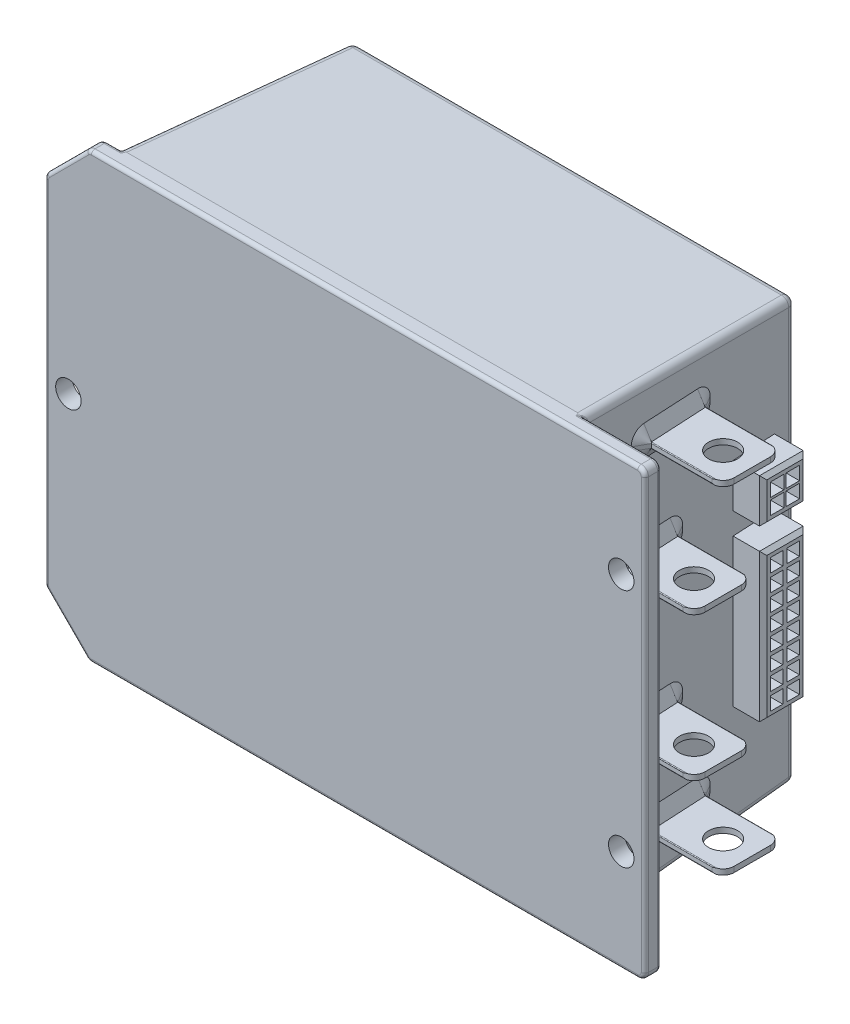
SolidWorks part; units mm, degrees
ref_plane "Plan1" through (0, 0, 0) normal (0, 0, 1) x (1, 0, 0)
ref_plane "Plan2" through (0, 0, 0) normal (0, 1, 0) x (1, 0, 0)
ref_plane "Plan3" through (0, 0, 0) normal (1, 0, 0) x (0, 0, -1)
sketch "Esquisse2" plane through (0, 0, 0) normal (0, 0, 1) x (1, 0, 0)
  line L0 (-64, 61) -> (64, 61)
  line L1 (-64, 61) -> (-64, -61)
  line L2 (64, -61) -> (-64, -61)
  line L3 (64, -61) -> (64, 61)
  line L4 (0, 45.8746) -> (0, -45.8746) construction
  line L5 (-80.7749, 0) -> (80.7749, 0) construction
  dimension "D1" = 128
  dimension "D2" = 122
extrude "Base-Extrusion" add sketch "Esquisse2" along normal blind 61
draft "Dépouille2" type of draft neutral plane draft angle 3 faces to draft 4 parameters "D1"=3
sketch "Esquisse3" plane through (0, 0, 61) normal (0, 0, 1) x (1, 0, 0)
  line L0 (-68, 61) -> (85, 61)
  line L1 (-80, 49) -> (-80, -49)
  line L2 (85, -61) -> (-68, -61)
  line L3 (85, -61) -> (85, 61)
  line L4 (-64, 61) -> (64, 61) construction
  line L5 (64, -61) -> (-64, -61) construction
  line L6 (64, -61) -> (64, 61) construction
  line L7 (-64, 61) -> (-64, -61) construction
  line L8 (-68, 61) -> (-80, 49)
  line L9 (-80, -49) -> (-68, -61)
  dimension "D1" = 21
  dimension "D2" = 16
  dimension "D3" = 12
  dimension "D4" = 45
  dimension "D5" = 12
extrude "Boss.-Extru.1" add sketch "Esquisse3" along normal blind 4.5
sketch "Esquisse4" plane through (0, 0, 65.5) normal (0, 0, 1) x (1, 0, 0)
  line L0 (-85.6585, 0) -> (85.6585, 0) construction
  line L1 (78.5, 62.3645) -> (78.5, -71.0751) construction
  line L4 (85, -61) -> (85, 61) construction
  circle A0 centre (-73.5, 0) radius 3.5
  circle A1 centre (78.5, 33) radius 3.5
  circle A3 centre (78.5, -33) radius 3.5
  dimension "D1" = 152
  dimension "D2" = 7
  dimension "D3" = 66
  dimension "D4" = 6.5
extrude "Enlèv. mat.-Extru.1" cut sketch "Esquisse4" against normal through all
fillet "Congé1" radius 2
fillet "Congé2" radius 1
fillet "Congé3" radius 1
sketch "Esquisse5" plane through (0, 0, 0) normal (1, 0, 0) x (0, 0, -1)
  line L0 (-74.5892, 0) -> (13.0799, 0) construction
  line L1 (-70.0338, -33) -> (7.7834, -33) construction
  line L2 (-36, 20.3) -> (-36, 19.2)
  line L4 (-61, 59) -> (-61, -59) construction
  line L5 (-43.8, -45.5) -> (-28.2, -45.5)
  line L6 (-44, -45.7) -> (-44, -46.8)
  line L7 (-28.2, -47) -> (-43.8, -47)
  line L8 (-28, -46.8) -> (-28, -45.7)
  line L9 (-28, 46.8) -> (-28, 45.7)
  line L10 (-28.2, 47) -> (-43.8, 47)
  line L11 (-44, 45.7) -> (-44, 46.8)
  line L13 (-43.8, 45.5) -> (-28.2, 45.5)
  line L14 (-51.8, -19) -> (-36.2, -19)
  line L15 (-52, -19.2) -> (-52, -20.3)
  line L16 (-36.2, -20.5) -> (-51.8, -20.5)
  line L17 (-36, -20.3) -> (-36, -19.2)
  line L18 (-36.2, 20.5) -> (-51.8, 20.5)
  line L19 (-52, 19.2) -> (-52, 20.3)
  line L20 (-51.8, 19) -> (-36.2, 19)
  arc A0 (-28.2, -45.5) -> (-28, -45.7) centre (-28.2, -45.7) cw
  arc A1 (-28, -46.8) -> (-28.2, -47) centre (-28.2, -46.8) cw
  arc A2 (-44, -46.8) -> (-43.8, -47) centre (-43.8, -46.8) ccw
  arc A3 (-43.8, -45.5) -> (-44, -45.7) centre (-43.8, -45.7) ccw
  arc A4 (-43.8, 45.5) -> (-44, 45.7) centre (-43.8, 45.7) cw
  arc A5 (-44, 46.8) -> (-43.8, 47) centre (-43.8, 46.8) cw
  arc A6 (-28, 46.8) -> (-28.2, 47) centre (-28.2, 46.8) ccw
  arc A7 (-28.2, 45.5) -> (-28, 45.7) centre (-28.2, 45.7) ccw
  arc A8 (-36.2, -19) -> (-36, -19.2) centre (-36.2, -19.2) cw
  arc A9 (-36, -20.3) -> (-36.2, -20.5) centre (-36.2, -20.3) cw
  arc A10 (-52, -20.3) -> (-51.8, -20.5) centre (-51.8, -20.3) ccw
  arc A11 (-51.8, -19) -> (-52, -19.2) centre (-51.8, -19.2) ccw
  arc A12 (-51.8, 19) -> (-52, 19.2) centre (-51.8, 19.2) cw
  arc A13 (-52, 20.3) -> (-51.8, 20.5) centre (-51.8, 20.3) cw
  arc A14 (-36, 20.3) -> (-36.2, 20.5) centre (-36.2, 20.3) ccw
  arc A15 (-36.2, 19) -> (-36, 19.2) centre (-36.2, 19.2) ccw
  point P13 (-28, -45.5)
  point P16 (-28, -47)
  point P19 (-44, -47)
  dimension "D3" = 0.2
  dimension "D8" = 0.2
  dimension "D1" = 16
  dimension "D2" = 1.5
  dimension "D4" = 19
  dimension "D5" = 33
  dimension "D6" = 12.5
  dimension "D7" = 17
  dimension "D9" = 1.5
  dimension "D10" = 16
  dimension "D11" = 9
extrude "Boss.-Extru.2" add sketch "Esquisse5" along normal up to surface (85 mm away)
sketch "Esquisse6" plane through (0, 20.5, 0) normal (0, 1, 0) x (-1, 0, 0)
  line L0 (-88.2041, 32.8007) -> (-78.5, 32.8007)
  line L1 (-88.2041, 32.8007) -> (-88.2041, 55.4851)
  line L2 (-78.5, 55.4851) -> (-88.2041, 55.4851)
  line L3 (-78.5, 55.4851) -> (-78.5, 52)
  line L4 (-82, 36) -> (-78.5, 36)
  line L5 (-85, 39) -> (-85, 49)
  line L6 (-78.5, 52) -> (-82, 52)
  line L7 (-85, 52) -> (-63.5283, 52) construction
  line L8 (-78.5, 61) -> (-78.5, 65.5) construction
  line L9 (-78.5, 36) -> (-78.5, 32.8007)
  line L10 (-85, 36.2) -> (-85, 51.8) construction
  line L11 (-85, 36) -> (-62.6898, 36) construction
  line L14 (-70.6796, 44) -> (-92.9618, 44) construction
  arc A0 (-85, 49) -> (-82, 52) centre (-82, 49) cw
  arc A1 (-85, 39) -> (-82, 36) centre (-82, 39) ccw
  circle A2 centre (-77, 44) radius 4
  dimension "D1" = 3
  dimension "D2" = 8
  dimension "D3" = 8
extrude "Enlèv. mat.-Extru.2" cut sketch "Esquisse6" against normal up to surface (41 mm away)
sketch "Esquisse7" plane through (0, -47, 0) normal (0, -1, 0) x (1, 0, 0)
  line L0 (89.5908, 51.428) -> (76.5147, 51.428)
  line L1 (89.5908, 51.428) -> (89.5908, 24.6402)
  line L2 (76.5147, 24.6402) -> (89.5908, 24.6402)
  line L3 (76.5147, 24.6402) -> (76.5147, 28)
  line L4 (82, 44) -> (76.5147, 44)
  line L5 (85, 41) -> (85, 31)
  line L6 (76.5147, 28) -> (82, 28)
  line L7 (85, 28) -> (62.2705, 28) construction
  line L8 (76.5147, 44) -> (76.5147, 51.428)
  line L9 (85, 43.8) -> (85, 28.2) construction
  line L10 (85, 44) -> (63.1091, 44) construction
  line L11 (88.0471, 36) -> (68.3724, 36) construction
  arc A0 (85, 31) -> (82, 28) centre (82, 31) cw
  arc A1 (85, 41) -> (82, 44) centre (82, 41) ccw
  circle A2 centre (77, 36) radius 4
  dimension "D1" = 3
  dimension "D2" = 8
  dimension "D3" = 8
extrude "Enlèv. mat.-Extru.3" cut sketch "Esquisse7" against normal blind 2
sketch "Esquisse8" plane through (0, 47, 0) normal (0, 1, 0) x (-1, 0, 0)
  line L0 (-87.5562, 24.8397) -> (-75.1472, 24.8397)
  line L1 (-87.5562, 24.8397) -> (-87.5562, 50.9732)
  line L2 (-75.1472, 50.9732) -> (-87.5562, 50.9732)
  line L3 (-75.1472, 50.9732) -> (-75.1472, 44)
  line L4 (-82, 28) -> (-75.1472, 28)
  line L5 (-85, 31) -> (-85, 41)
  line L6 (-75.1472, 44) -> (-82, 44)
  line L7 (-85, 44) -> (-63.1091, 44) construction
  line L8 (-75.1472, 28) -> (-75.1472, 24.8397)
  line L9 (-85, 43.8) -> (-85, 28.2) construction
  line L10 (-85, 28) -> (-62.2705, 28) construction
  line L11 (-90.3771, 36) -> (-66.9068, 36) construction
  arc A0 (-85, 41) -> (-82, 44) centre (-82, 41) cw
  arc A1 (-82, 28) -> (-85, 31) centre (-82, 31) cw
  circle A2 centre (-77, 36) radius 4
  dimension "D1" = 3
  dimension "D2" = 8
  dimension "D3" = 8
extrude "Enlèv. mat.-Extru.4" cut sketch "Esquisse8" against normal blind 2
chamfer "Chanfrein1" distance 2 angle 60
sketch "Esquisse9" plane through (0, 0, 0) normal (1, 0, 0) x (0, 0, -1)
  line L0 (-18, 28) -> (-6, 28)
  line L1 (-18, 28) -> (-18, 16)
  line L2 (-6, 16) -> (-18, 16)
  line L3 (-6, 16) -> (-6, 28)
  line L4 (-18, 10) -> (-6, 10)
  line L5 (-18, 10) -> (-18, -30.6)
  line L6 (-6, -30.6) -> (-18, -30.6)
  line L7 (-6, -30.6) -> (-6, 10)
  line L8 (-11.7, 26) -> (-8, 26)
  line L9 (-11.7, 26) -> (-11.7, 22.3)
  line L10 (-8, 22.3) -> (-11.7, 22.3)
  line L11 (-8, 22.3) -> (-8, 26)
  line L13 (-8, 8) -> (-11.4, 8)
  line L14 (-8, 8) -> (-8, 4.3)
  line L15 (-11.4, 4.3) -> (-8, 4.3)
  line L16 (-11.4, 4.3) -> (-11.4, 8)
  line L17 (-12, 30.1492) -> (-12, -35.6662) construction
  line L18 (-21.9002, 22) -> (1.0998, 22) construction
  line L19 (0, 55.9052) -> (0, -55.9052) construction
  line L20 (50, 0) -> (-50, 0) construction
  line L21 (-16, 22.3) -> (-16, 26)
  line L22 (-16, 22.3) -> (-12.3, 22.3)
  line L23 (-12.3, 26) -> (-12.3, 22.3)
  line L24 (-12.3, 26) -> (-16, 26)
  line L25 (-12.3, 18) -> (-16, 18)
  line L26 (-12.3, 18) -> (-12.3, 21.7)
  line L27 (-16, 21.7) -> (-12.3, 21.7)
  line L28 (-16, 21.7) -> (-16, 18)
  line L29 (-8, 21.7) -> (-8, 18)
  line L30 (-8, 21.7) -> (-11.7, 21.7)
  line L31 (-11.7, 18) -> (-11.7, 21.7)
  line L32 (-11.7, 18) -> (-8, 18)
  line L33 (-22.4192, 3.8) -> (-4.0583, 3.8) construction
  line L34 (-12.6, 4.3) -> (-12.6, 8)
  line L35 (-12.6, 4.3) -> (-16, 4.3)
  line L36 (-16, 8) -> (-16, 4.3)
  line L37 (-16, 8) -> (-12.6, 8)
  line L38 (-16, -0.4) -> (-12.6, -0.4)
  line L39 (-16, -0.4) -> (-16, 3.3)
  line L40 (-12.6, 3.3) -> (-16, 3.3)
  line L41 (-12.6, 3.3) -> (-12.6, -0.4)
  line L42 (-11.4, 3.3) -> (-11.4, -0.4)
  line L43 (-11.4, 3.3) -> (-8, 3.3)
  line L44 (-8, -0.4) -> (-8, 3.3)
  line L45 (-8, -0.4) -> (-11.4, -0.4)
  line L46 (-22.4192, -0.9) -> (-3.4049, -0.9) construction
  line L47 (-8, -1.4) -> (-11.4, -1.4)
  line L48 (-8, -1.4) -> (-8, -5.1)
  line L49 (-11.4, -5.1) -> (-8, -5.1)
  line L50 (-11.4, -5.1) -> (-11.4, -1.4)
  line L51 (-12.6, -5.1) -> (-12.6, -1.4)
  line L52 (-12.6, -5.1) -> (-16, -5.1)
  line L53 (-16, -1.4) -> (-16, -5.1)
  line L54 (-16, -1.4) -> (-12.6, -1.4)
  line L55 (-16, -9.8) -> (-12.6, -9.8)
  line L56 (-16, -9.8) -> (-16, -6.1)
  line L57 (-12.6, -6.1) -> (-16, -6.1)
  line L58 (-12.6, -6.1) -> (-12.6, -9.8)
  line L59 (-11.4, -6.1) -> (-11.4, -9.8)
  line L60 (-11.4, -6.1) -> (-8, -6.1)
  line L61 (-8, -9.8) -> (-8, -6.1)
  line L62 (-8, -9.8) -> (-11.4, -9.8)
  line L63 (-21.1124, -10.3) -> (-4.0583, -10.3) construction
  line L64 (-8, -10.8) -> (-11.4, -10.8)
  line L65 (-8, -10.8) -> (-8, -14.5)
  line L66 (-11.4, -14.5) -> (-8, -14.5)
  line L67 (-11.4, -14.5) -> (-11.4, -10.8)
  line L68 (-12.6, -14.5) -> (-12.6, -10.8)
  line L69 (-12.6, -14.5) -> (-16, -14.5)
  line L70 (-16, -10.8) -> (-16, -14.5)
  line L71 (-16, -10.8) -> (-12.6, -10.8)
  line L72 (-16, -19.2) -> (-12.6, -19.2)
  line L73 (-16, -19.2) -> (-16, -15.5)
  line L74 (-12.6, -15.5) -> (-16, -15.5)
  line L75 (-12.6, -15.5) -> (-12.6, -19.2)
  line L76 (-11.4, -15.5) -> (-11.4, -19.2)
  line L77 (-11.4, -15.5) -> (-8, -15.5)
  line L78 (-8, -19.2) -> (-8, -15.5)
  line L79 (-8, -19.2) -> (-11.4, -19.2)
  line L80 (-8, -20.2) -> (-11.4, -20.2)
  line L81 (-8, -20.2) -> (-8, -23.9)
  line L82 (-11.4, -23.9) -> (-8, -23.9)
  line L83 (-11.4, -23.9) -> (-11.4, -20.2)
  line L84 (-12.6, -23.9) -> (-12.6, -20.2)
  line L85 (-12.6, -23.9) -> (-16, -23.9)
  line L86 (-16, -20.2) -> (-16, -23.9)
  line L87 (-16, -20.2) -> (-12.6, -20.2)
  line L88 (-16, -28.6) -> (-12.6, -28.6)
  line L89 (-16, -28.6) -> (-16, -24.9)
  line L90 (-12.6, -24.9) -> (-16, -24.9)
  line L91 (-12.6, -24.9) -> (-12.6, -28.6)
  line L92 (-11.4, -24.9) -> (-11.4, -28.6)
  line L93 (-11.4, -24.9) -> (-8, -24.9)
  line L94 (-8, -28.6) -> (-8, -24.9)
  line L95 (-8, -28.6) -> (-11.4, -28.6)
  dimension "D1" = 12
  dimension "D2" = 12
  dimension "D3" = 12
  dimension "D4" = 22
  dimension "D5" = 0.3
  dimension "D6" = 0.3
  dimension "D7" = 2
  dimension "D8" = 2
  dimension "D9" = 6
  dimension "D10" = 2
  dimension "D11" = 0.6
  dimension "D12" = 3.7
  dimension "D13" = 0.5
  dimension "D14" = 0.5
  dimension "D15" = 0.5
  dimension "D16" = 2
extrude "Boss.-Extru.3" add sketch "Esquisse9" along normal blind 70
chamfer "Chanfrein2" distance 1 angle 45
